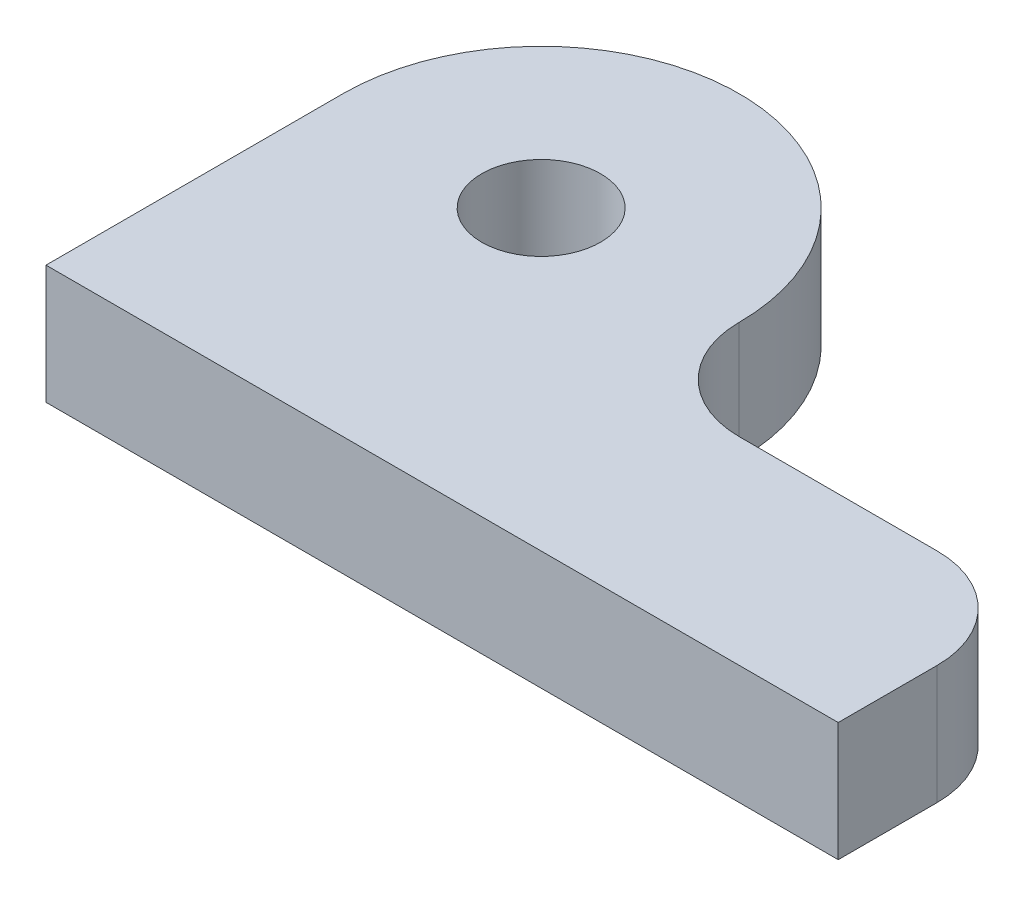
SolidWorks part; units mm, degrees
ref_plane "Face" through (0, 0, 0) normal (0, 0, 1) x (1, 0, 0)
ref_plane "Dessus" through (0, 0, 0) normal (0, 1, 0) x (1, 0, 0)
ref_plane "Droite" through (0, 0, 0) normal (1, 0, 0) x (0, 0, -1)
sketch "Esquisse1" plane through (0, 0, 0) normal (0, 1, 0) x (1, 0, 0)
  line L0 (-12.5523, 0) -> (113.222, 0) construction
  line L1 (0, -13.7528) -> (0, 70.293) construction
  line L2 (10, -6.9365) -> (10, 31.2792) construction
  line L3 (-12.5523, 5) -> (104.5878, 5) construction
  line L4 (6.8137, 15) -> (36.4253, 15) construction
  line L5 (20, 10) -> (75.5349, 10) construction
  line L6 (25, 7.143) -> (25, 28.7092) construction
  line L7 (40, -13.7528) -> (40, 28.7092) construction
  line L8 (25, 10) -> (35, 10)
  line L9 (40, 5) -> (40, 0)
  line L10 (40, 0) -> (0, 0)
  line L11 (0, 0) -> (0, 15)
  arc A0 (20, 15) -> (0, 15) centre (10, 15) ccw
  arc A1 (20, 15) -> (25, 10) centre (25, 15) ccw
  arc A2 (35, 10) -> (40, 5) centre (35, 5) cw
  circle A3 centre (10, 15) radius 3
  point P28 (40, 10)
  dimension "D6" = 5
  dimension "D4" = 10
extrude "Extrusion1" add sketch "Esquisse1" along normal blind 6
